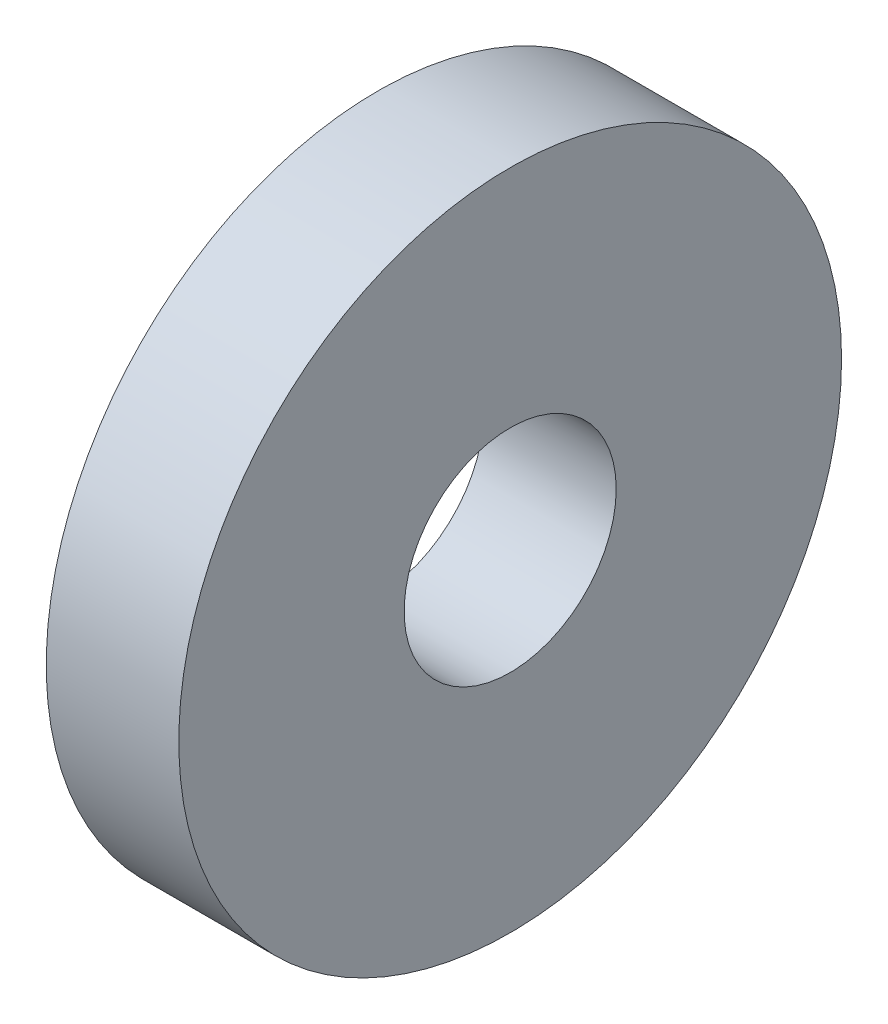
SolidWorks part; units mm, degrees
ref_plane "Front Plane" through (0, 0, 0) normal (0, 0, 1) x (1, 0, 0)
ref_plane "Top Plane" through (0, 0, 0) normal (0, 1, 0) x (1, 0, 0)
ref_plane "Right Plane" through (0, 0, 0) normal (1, 0, 0) x (0, 0, -1)
sketch "Sketch1" plane through (0, 0, 0) normal (1, 0, 0) x (0, 0, -1)
  circle A0 centre (0, 0) radius 9.525
  circle A1 centre (0, 0) radius 3.048
extrude "Extrude1" add sketch "Sketch1" along normal blind 3.81
